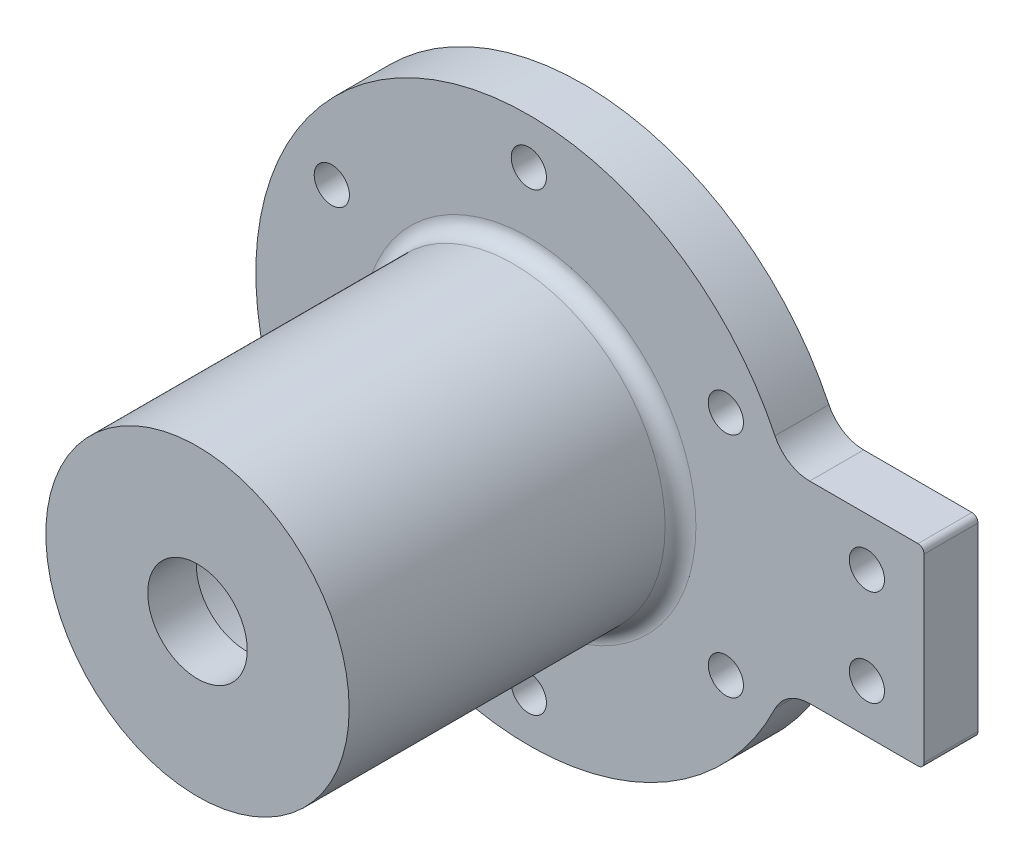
SolidWorks part; units mm, degrees
ref_plane "Front Plane" through (0, 0, 0) normal (0, 0, 1) x (1, 0, 0)
ref_plane "Top Plane" through (0, 0, 0) normal (0, 1, 0) x (1, 0, 0)
ref_plane "Right Plane" through (0, 0, 0) normal (1, 0, 0) x (0, 0, -1)
sketch "Sketch1" plane through (0, 0, 0) normal (0, 0, 1) x (1, 0, 0)
  circle A0 centre (0, 0) radius 20
  circle A1 centre (0, 0) radius 25
  dimension "D1" = 40
  dimension "D2" = 5
extrude "Boss-Extrude1" add sketch "Sketch1" along normal blind 63.5
sketch "Sketch2" plane through (0, 0, 63.5) normal (0, 0, 1) x (1, 0, 0)
  circle A0 centre (0, 0) radius 20 construction
  circle A1 centre (0, 0) radius 20
  circle A2 centre (0, 0) radius 6.15
  dimension "D1" = 12.3
extrude "Boss-Extrude2" add sketch "Sketch2" against normal blind 8
sketch "Sketch3" plane through (0, 0, 0) normal (0, 0, 1) x (1, 0, 0)
  circle A0 centre (0, 0) radius 25 construction
  circle A1 centre (0, 0) radius 25
  circle A17 centre (0, 0) radius 45
extrude "Boss-Extrude3" add sketch "Sketch3" along normal blind 8.89
sketch "Sketch4" plane through (0, 0, 0) normal (0, 0, -1) x (-1, 0, 0)
  circle A3 centre (0, 37.5) radius 2.75
  circle A7 centre (32.476, 18.75) radius 2.75
  circle A11 centre (32.476, -18.75) radius 2.75
  circle A15 centre (0, -37.5) radius 2.75
  circle A17 centre (-32.476, -18.75) radius 2.75
  circle A19 centre (-32.476, 18.75) radius 2.75
extrude "Cut-Extrude1" cut sketch "Sketch4" against normal through all
ref_plane "Plane1" through (0, 0, 38.1) normal (0, 0, 1) x (1, 0, 0)
sketch "Sketch5" plane through (0, 0, 63.5) normal (0, 0, 1) x (1, 0, 0)
  circle A0 centre (0, 0) radius 6.15 construction
  circle A1 centre (0, 0) radius 6.15
extrude "Boss-Extrude4" add sketch "Sketch5" against normal up to surface (8 mm away)
sketch "Sketch7" plane through (0, 0, 55.5) normal (0, 0, -1) x (-1, 0, 0)
  arc A2 (-0.3742, -7.6038) -> (-6.398, -4.1259) centre (0, 0) ccw
  arc A3 (-6.398, -4.1259) -> (-0.3742, -7.6038) centre (0, 0) ccw
  arc A4 (-7.0384, -4.5389) -> (-0.4116, -8.3649) centre (0, 0) ccw
  arc A5 (-0.4116, -8.3649) -> (-7.0384, -4.5389) centre (0, 0) ccw
  dimension "D1" = 0.762
extrude "Cut-Extrude2" cut sketch "Sketch7" against normal up to next contours A2 A3
sketch "Sketch9" plane through (0, 0, 0) normal (0, 0, -1) x (-1, 0, 0)
  line L0 (0, -45) -> (-25.4, -45)
  line L1 (0, 0) -> (-72.2057, 0) construction
  line L2 (-61.51, 15.875) -> (-61.51, -15.875)
  line L3 (-61.51, -15.875) -> (-42.1068, -15.875)
  line L4 (-61.51, 15.875) -> (-42.1068, 15.875)
  circle A1 centre (0, 0) radius 45
  circle A2 centre (0, 0) radius 45
  point P6 (-61.51, 0)
  point P8 (-45, 0)
  point P11 (-61.51, 0)
  dimension "D2" = 25.4
  dimension "D3" = 16.51
  dimension "D4" = 31.75
  dimension "D1" = 0
extrude "Boss-Extrude5" add sketch "Sketch9" against normal up to surface (8.89 mm away) contours A2 L1 L2 L3 | L1 L4 L2 M14
fillet "Fillet1" radius 6.35 4 edges at (42.1068, 15.875, 4.445) (61.51, 15.875, 4.445) (61.51, -15.875, 4.445) (42.1068, -15.875, 4.445)
sketch "Sketch10" plane through (0, 0, 0) normal (0, 0, -1) x (-1, 0, 0)
  line L0 (-50.7256, -15.875) -> (-50.7256, 15.875) construction
  line L1 (-55.16, 9.525) -> (-50.7256, 9.525) construction
  line L2 (-55.16, -9.525) -> (-50.7256, -9.525) construction
  line L3 (-46.2912, 15.875) -> (-55.16, 15.875)
  line L4 (-61.51, 9.525) -> (-61.51, -9.525)
  line L5 (-55.16, -15.875) -> (-46.2912, -15.875)
  line L6 (-46.2912, 15.875) -> (-55.16, 15.875)
  line L7 (-61.51, 9.525) -> (-61.51, -9.525)
  line L8 (-55.16, -15.875) -> (-46.2912, -15.875)
  line L9 (-50.7256, 0) -> (-55.606, 0) construction
  arc A5 (-55.16, 15.875) -> (-61.51, 9.525) centre (-55.16, 9.525) ccw
  arc A6 (-61.51, -9.525) -> (-55.16, -15.875) centre (-55.16, -9.525) ccw
  arc A7 (-40.5667, -19.4766) -> (-46.2912, -15.875) centre (-46.2912, -22.225) ccw
  arc A8 (-40.5667, -19.4766) -> (-40.5667, 19.4766) centre (0, 0) ccw
  arc A9 (-46.2912, 15.875) -> (-40.5667, 19.4766) centre (-46.2912, 22.225) ccw
  arc A10 (-55.16, 15.875) -> (-61.51, 9.525) centre (-55.16, 9.525) ccw
  arc A11 (-61.51, -9.525) -> (-55.16, -15.875) centre (-55.16, -9.525) ccw
  arc A12 (-40.5667, -19.4766) -> (-46.2912, -15.875) centre (-46.2912, -22.225) ccw
  arc A13 (-40.5667, -19.4766) -> (-40.5667, 19.4766) centre (0, 0) ccw
  arc A14 (-46.2912, 15.875) -> (-40.5667, 19.4766) centre (-46.2912, 22.225) ccw
  point P12 (-52.5216, -7.7289)
  point P20 (-52.5216, 7.7289)
  dimension "D2" = 2.54
  dimension "D1" = 0
sketch "Sketch17" plane through (0, 0, 8.89) normal (0, 0, -1) x (-1, 0, 0)
  line L11 (-46.2912, 15.875) -> (-55.16, 15.875)
  line L12 (-61.51, 9.525) -> (-61.51, -9.525)
  line L13 (-55.16, -15.875) -> (-46.2912, -15.875)
  line L14 (-46.2912, 15.875) -> (-55.16, 15.875)
  line L15 (-61.51, 9.525) -> (-61.51, -9.525)
  line L16 (-48.8312, 15.875) -> (-62.6005, 15.875)
  line L17 (-65.1405, 13.335) -> (-65.1405, 6.7733)
  line L18 (-65.1405, 6.7733) -> (-65.1405, -6.7733)
  line L19 (-65.1405, -6.7733) -> (-65.1405, -13.335)
  line L20 (-62.6005, -15.875) -> (-48.8312, -15.875)
  line L21 (-46.2912, -13.335) -> (-46.2912, -4.2333)
  line L22 (-46.2912, -4.2333) -> (-46.2912, 4.2333)
  line L23 (-46.2912, 4.2333) -> (-46.2912, 13.335)
  line L24 (-55.16, -15.875) -> (-46.2912, -15.875)
  arc A8 (-62.6005, 15.875) -> (-65.1405, 13.335) centre (-62.6005, 13.335) ccw
  arc A9 (-65.1405, -13.335) -> (-62.6005, -15.875) centre (-62.6005, -13.335) ccw
  arc A10 (-48.8312, -15.875) -> (-46.2912, -13.335) centre (-48.8312, -13.335) ccw
  arc A11 (-46.2912, 13.335) -> (-48.8312, 15.875) centre (-48.8312, 13.335) ccw
  arc A13 (-55.16, 15.875) -> (-61.51, 9.525) centre (-55.16, 9.525) ccw
  arc A14 (-61.51, -9.525) -> (-55.16, -15.875) centre (-55.16, -9.525) ccw
  arc A15 (-40.5667, -19.4766) -> (-46.2912, -15.875) centre (-46.2912, -22.225) ccw
  arc A16 (-40.5667, -19.4766) -> (-40.5667, 19.4766) centre (0, 0) ccw
  arc A17 (-46.2912, 15.875) -> (-40.5667, 19.4766) centre (-46.2912, 22.225) ccw
  arc A18 (-55.16, 15.875) -> (-61.51, 9.525) centre (-55.16, 9.525) ccw
  arc A19 (-61.51, -9.525) -> (-55.16, -15.875) centre (-55.16, -9.525) ccw
  arc A20 (-40.5667, -19.4766) -> (-46.2912, -15.875) centre (-46.2912, -22.225) ccw
  arc A21 (-40.5667, -19.4766) -> (-40.5667, 19.4766) centre (0, 0) ccw
  arc A22 (-46.2912, 15.875) -> (-40.5667, 19.4766) centre (-46.2912, 22.225) ccw
  dimension "D1" = 0
extrude "Boss-Extrude6" add sketch "Sketch17" along normal up to surface (8.89 mm away) contours A19 L15 A18 L16 A8 L17 L18 L19 A9 L20
sketch "Sketch18" plane through (0, 0, 0) normal (0, 0, -1) x (-1, 0, 0)
  line L2 (-55.7158, 0) -> (-55.7158, -15.875) construction
  line L3 (-62.6005, -15.875) -> (-46.2912, -15.875) construction
  line L4 (-55.7158, 0) -> (-51.9674, 0) construction
  point P2 (-55.7158, -7.9375)
  point P13 (-55.7158, -7.9375)
  point P14 (-55.7158, 7.9375)
sketch "Sketch21" plane through (0, 0, 0) normal (0, 0, -1) x (-1, 0, 0)
  point P0 (-55.7158, 7.9375)
  point P2 (-55.7158, -7.9375)
hole_wizard "M5 Clearance Hole1" positions "Sketch21" profile "Sketch20" hole size "M5" standard "ANSI Metric"
sketch "Sketch20" plane through (55.7158, 7.9375, 0) normal (1, 0, 0) x (0, 1, 0)
  line L0 (0, 0) -> (0, 63.5)
  line L1 (0, 63.5) -> (2.9, 63.5)
  line L2 (2.9, 63.5) -> (2.9, 0)
  line L5 (2.9, 0) -> (0, 0)
  line L11 (0, -6.35) -> (0, 107.95) construction
  dimension "Thru Hole Dia." = 5.8
  dimension "Thru Hole Depth" = 63.5
sketch "Sketch22" plane through (0, 0, 0) normal (0, 0, -1) x (-1, 0, 0)
  circle A1 centre (0, 37.5) radius 2.75
  circle A2 centre (0, 37.5) radius 2.75
  circle A3 centre (-32.476, 18.75) radius 2.75
  circle A4 centre (-32.476, 18.75) radius 2.75
  circle A5 centre (-32.476, -18.75) radius 2.75
  circle A6 centre (-32.476, -18.75) radius 2.75
  circle A7 centre (0, -37.5) radius 2.75
  circle A8 centre (0, -37.5) radius 2.75
  circle A9 centre (32.476, -18.75) radius 2.75
  circle A10 centre (32.476, -18.75) radius 2.75
  circle A11 centre (32.476, 18.75) radius 2.75
  circle A12 centre (32.476, 18.75) radius 2.75
  circle A13 centre (0, 0) radius 20
  circle A14 centre (0, 0) radius 20
  circle A15 centre (-55.7158, -7.9375) radius 2.9
  circle A16 centre (-55.7158, -7.9375) radius 2.9
  circle A17 centre (-55.7158, 7.9375) radius 2.9
  circle A18 centre (-55.7158, 7.9375) radius 2.9
  dimension "D1" = 0
  dimension "D2" = 0
  dimension "D3" = 0
  dimension "D4" = 0
  dimension "D5" = 0
  dimension "D6" = 0
  dimension "D7" = 0
  dimension "D8" = 0
  dimension "D9" = 0
sketch "Sketch25" plane through (0, 0, 0) normal (0, 0, -1) x (-1, 0, 0)
  point P0 (-32.476, 18.75)
  point P3 (0, 37.5)
  point P6 (32.476, 18.75)
  point P9 (32.476, -18.75)
  point P12 (0, -37.5)
  point P15 (-32.476, -18.75)
hole_wizard "M5 Clearance Hole2" positions "Sketch25" profile "Sketch24" hole size "M5" standard "ANSI Metric"
sketch "Sketch24" plane through (32.476, 18.75, 0) normal (1, 0, 0) x (0, 1, 0)
  line L0 (0, 0) -> (0, 63.5)
  line L1 (0, 63.5) -> (2.9, 63.5)
  line L2 (2.9, 63.5) -> (2.9, 0)
  line L5 (2.9, 0) -> (0, 0)
  line L11 (0, -6.35) -> (0, 107.95) construction
  dimension "Thru Hole Dia." = 5.8
  dimension "Thru Hole Depth" = 63.5
sketch "Sketch26" plane through (0, 0, 63.5) normal (0, 0, 1) x (1, 0, 0)
  circle A1 centre (0, 0) radius 25
  circle A2 centre (0, 0) radius 25
  dimension "D1" = 0
extrude "Boss-Extrude7" add sketch "Sketch26" against normal up to surface (8 mm away)
fillet "Fillet2" radius 2.54 1 edges at (25, 0, 8.89)
sketch "Sketch27" plane through (0, 0, 63.5) normal (0, 0, 1) x (1, 0, 0)
  circle A0 centre (0, 0) radius 8.2
  circle A1 centre (0, 0) radius 25
  circle A2 centre (0, 0) radius 25
  dimension "D2" = 16.4
  dimension "D1" = 0
extrude "Cut-Extrude3" cut sketch "Sketch27" against normal up to surface (8 mm away) contours A0
sketch "Sketch29" plane through (0, 0, 8.89) normal (0, 0, -1) x (-1, 0, 0)
  line L9 (-46.2912, 15.875) -> (-62.6005, 15.875)
  line L10 (-65.1405, 13.335) -> (-65.1405, -13.335)
  line L11 (-62.6005, -15.875) -> (-46.2912, -15.875)
  line L12 (-46.2912, 5.2333) -> (-46.2912, 14.875)
  line L13 (-47.2912, 15.875) -> (-64.1405, 15.875)
  line L14 (-65.1405, 14.875) -> (-65.1405, -14.875)
  line L15 (-64.1405, -15.875) -> (-47.2912, -15.875)
  line L16 (-46.2912, -14.875) -> (-46.2912, -5.2333)
  line L17 (-46.2912, -5.2333) -> (-46.2912, 5.2333)
  line L18 (-46.2912, 15.875) -> (-62.6005, 15.875)
  line L19 (-65.1405, 13.335) -> (-65.1405, -13.335)
  line L20 (-62.6005, -15.875) -> (-46.2912, -15.875)
  arc A8 (-46.2912, 14.875) -> (-47.2912, 15.875) centre (-47.2912, 14.875) ccw
  arc A9 (-64.1405, 15.875) -> (-65.1405, 14.875) centre (-64.1405, 14.875) ccw
  arc A10 (-65.1405, -14.875) -> (-64.1405, -15.875) centre (-64.1405, -14.875) ccw
  arc A11 (-47.2912, -15.875) -> (-46.2912, -14.875) centre (-47.2912, -14.875) ccw
  arc A13 (-62.6005, 15.875) -> (-65.1405, 13.335) centre (-62.6005, 13.335) ccw
  arc A14 (-65.1405, -13.335) -> (-62.6005, -15.875) centre (-62.6005, -13.335) ccw
  arc A15 (-40.5667, -19.4766) -> (-46.2912, -15.875) centre (-46.2912, -22.225) ccw
  arc A16 (-40.5667, -19.4766) -> (-40.5667, 19.4766) centre (0, 0) ccw
  arc A17 (-46.2912, 15.875) -> (-40.5667, 19.4766) centre (-46.2912, 22.225) ccw
  arc A18 (-62.6005, 15.875) -> (-65.1405, 13.335) centre (-62.6005, 13.335) ccw
  arc A19 (-65.1405, -13.335) -> (-62.6005, -15.875) centre (-62.6005, -13.335) ccw
  arc A20 (-40.5667, -19.4766) -> (-46.2912, -15.875) centre (-46.2912, -22.225) ccw
  arc A21 (-40.5667, -19.4766) -> (-40.5667, 19.4766) centre (0, 0) ccw
  arc A22 (-46.2912, 15.875) -> (-40.5667, 19.4766) centre (-46.2912, 22.225) ccw
  dimension "D1" = 0
extrude "Boss-Extrude8" add sketch "Sketch29" along normal up to surface (8.89 mm away) contours A19 L14 A10 L15 | A18 L13 A9 L14
